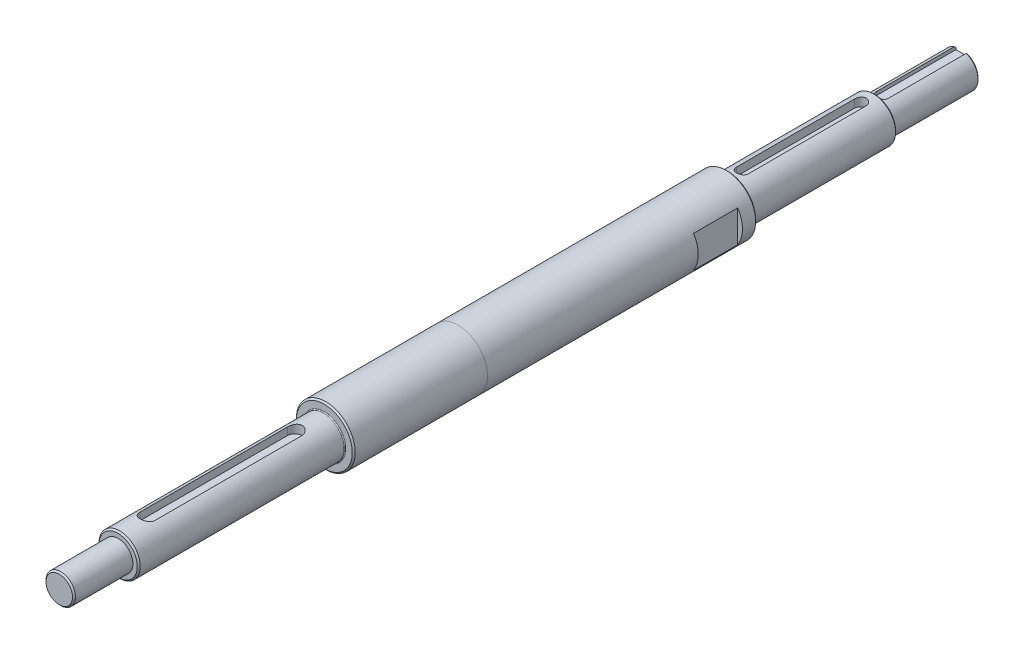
SolidWorks part; units mm, degrees
ref_plane "Face" through (0, 0, 0) normal (0, 0, 1) x (1, 0, 0)
ref_plane "Dessus" through (0, 0, 0) normal (0, 1, 0) x (1, 0, 0)
ref_plane "Droite" through (0, 0, 0) normal (1, 0, 0) x (0, 0, -1)
sketch "Esquisse1" plane through (0, 0, 0) normal (1, 0, 0) x (0, 0, -1)
  line L0 (0, 0) -> (408.6171, 0) construction
  line L1 (227, 10) -> (90, 10)
  line L2 (90, 10) -> (90, 7)
  line L3 (90, 7) -> (20, 7)
  line L4 (0, 5) -> (0, 0)
  line L5 (0, 0) -> (306.5, 0)
  line L6 (227, 7.5) -> (227, 10)
  line L7 (0, 5) -> (20, 5)
  line L8 (20, 5) -> (20, 7)
  line L13 (227, 7.5) -> (277, 7.5)
  line L14 (306.5, 6) -> (306.5, 0)
  line L15 (277, 7.5) -> (277, 6)
  line L16 (277, 6) -> (306.5, 6)
  dimension "D1" = 20
  dimension "D2" = 137
  dimension "D3" = 10
  dimension "D4" = 14
  dimension "D5" = 20
  dimension "D6" = 70
  dimension "D10" = 15
  dimension "D11" = 50
  dimension "D12" = 29.5
  dimension "D13" = 12
revolve "Révolution1" add sketch "Esquisse1" angle 360 about L0
ref_plane "Plan1" through (0, 4, 0) normal (0, 1, 0) x (-1, 0, 0)
sketch "Esquisse3" plane through (0, 4, 0) normal (0, 1, 0) x (-1, 0, 0)
  line L0 (0, 0) -> (0, -251.3749) construction
  line L1 (-2.5, -30) -> (2.5, -30) construction
  line L2 (-2.5, -30) -> (-2.5, -80)
  line L3 (-2.5, -80) -> (2.5, -80) construction
  line L4 (2.5, -30) -> (2.5, -80)
  line L5 (10, -90) -> (-10, -90) construction
  arc A0 (2.5, -30) -> (-2.5, -30) centre (0, -30) ccw
  arc A1 (-2.5, -80) -> (2.5, -80) centre (0, -80) ccw
  dimension "D1" = 5
  dimension "D2" = 50
  dimension "D3" = 10
extrude "Enlèv. mat.-Extru.1" cut sketch "Esquisse3" along normal through all
chamfer "Chanfrein1" distance 0.5 angle 45 6 edges at (10, 0, -227) (10, 0, -90) (5, 0, 0) (7, 0, -20) (6, 0, -306.5) (7.5, 0, -277)
fillet "Congé1" radius 0.3 1 edges at (7, 0, -90)
ref_plane "Plan2" through (0, 4.5, 0) normal (0, 1, 0) x (-1, 0, 0)
sketch "Esquisse4" plane through (0, 4.5, 0) normal (0, 1, 0) x (-1, 0, 0)
  line L0 (-2, -232) -> (2, -232) construction
  line L1 (-2, -232) -> (-2, -272)
  line L2 (-2, -272) -> (2, -272) construction
  line L3 (2, -232) -> (2, -272)
  line L4 (0, 0) -> (0, -349.0197) construction
  line L5 (-7.5, -227) -> (7.5, -227) construction
  arc A0 (2, -232) -> (-2, -232) centre (0, -232) ccw
  arc A1 (-2, -272) -> (2, -272) centre (0, -272) ccw
  dimension "D2" = 40
  dimension "D3" = 5
  dimension "D1" = 4
extrude "Enlèv. mat.-Extru.2" cut sketch "Esquisse4" along normal blind 10
hole_wizard "Trou taraudé M61" positions "Esquisse6" profile "Esquisse5" tap size "M6" standard "ISO"
sketch "Esquisse6" plane through (0, 0, -306.5) normal (0, 0, -1) x (-1, 0, 0)
  point P0 (0, 0)
sketch "Esquisse5" plane through (0, 0, -306.5) normal (1, 0, 0) x (0, 1, 0)
  line L0 (0, 0) -> (0, 18.5022)
  line L1 (0, 18.5022) -> (2.5, 17)
  line L2 (2.5, 17) -> (2.5, 0)
  line L5 (2.5, 0) -> (0, 0)
  line L10 (0, 18.5022) -> (-2.5, 17) construction
  line L11 (0, -6.35) -> (0, 107.95) construction
  dimension "Diamètre du trou pour taraudage" = 5
  dimension "Profondeur du trou pour taraudage" = 17
  dimension "Angle de pointe" = 118
sketch "Esquisse7" plane through (0, 0, 0) normal (0, 1, 0) x (1, 0, 0)
  line L0 (-8.4, 182) -> (-8.4, 222)
  line L1 (19.5763, 207) -> (8.4, 207)
  line L2 (19.5763, 207) -> (19.5763, 222)
  line L3 (19.5763, 222) -> (8.4, 222)
  line L4 (8.4, 207) -> (8.4, 222)
  line L5 (0, 305.9814) -> (0, 199.2156) construction
  line L6 (0, 289.5) -> (0, 306.5) construction
  line L7 (0, 0) -> (0, 408.6171) construction
  line L8 (-19.5763, 222) -> (-8.4, 222)
  line L9 (-19.5763, 182) -> (-19.5763, 222)
  line L10 (-19.5763, 182) -> (-8.4, 182)
  line L11 (7.5, 227) -> (-7.5, 227) construction
  dimension "D1" = 16.8
  dimension "D2" = 5
  dimension "D3" = 15
  dimension "D4" = 40
extrude "Enlèv. mat.-Extru.3" cut sketch "Esquisse7" against normal mid plane 50
ref_plane "Plan3" through (0, 6, -291.5) normal (0, 1, 0) x (-1, 0, 0)
sketch "Esquisse9" plane through (0, 6, -291.5) normal (0, 1, 0) x (-1, 0, 0)
  line L0 (0, -0.0646) -> (0, -19.442) construction
  line L1 (0, 2) -> (0, -15) construction
  line L2 (0, 291.5) -> (0, -117.1171) construction
  line L3 (-5.5, -15) -> (5.5, -15) construction
  line L4 (-2, -15) -> (2, -15)
  line L5 (-2, -15) -> (-2, 12)
  line L7 (2, -15) -> (2, 12)
  arc A0 (-2, 12) -> (2, 12) centre (0, 12) cw
  dimension "D2" = 29
  dimension "D1" = 4
extrude "Enlèv. mat.-Extru.4" cut sketch "Esquisse9" against normal blind 1.5
sketch "Esquisse10" plane through (-23.128, 23.958, 0) normal (0.6945, -0.7195, 0) x (0, 0, 1)
  line L1 (-135.4739, -21.5) -> (-135.4739, 21.5)
